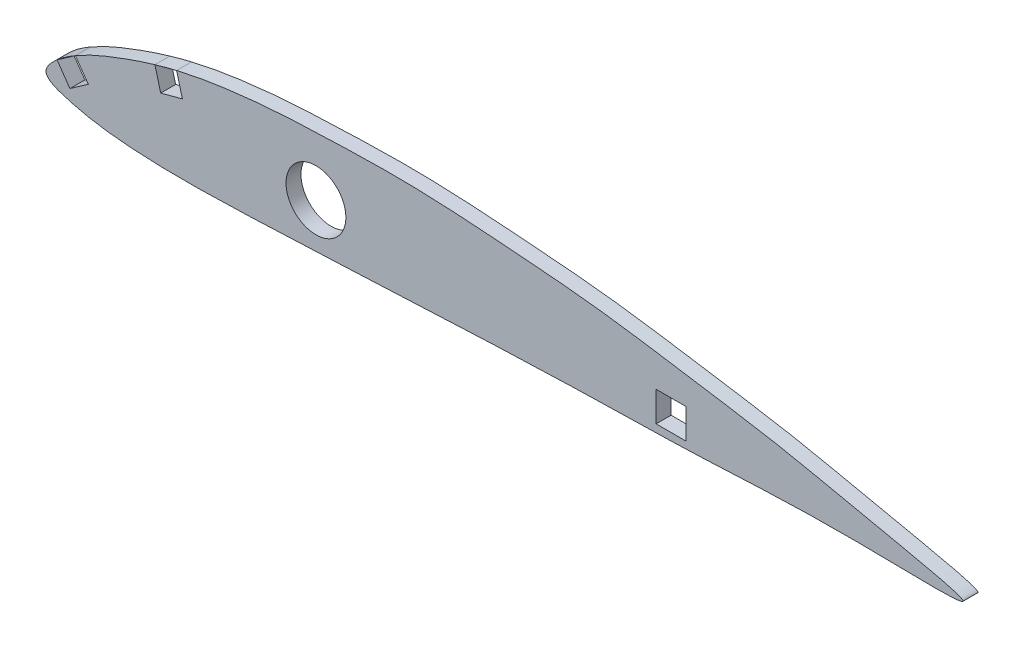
SolidWorks part; units mm, degrees
ref_plane "Front Plane" through (0, 0, 0) normal (0, 0, 1) x (1, 0, 0)
ref_plane "Top Plane" through (0, 0, 0) normal (0, 1, 0) x (1, 0, 0)
ref_plane "Right Plane" through (0, 0, 0) normal (1, 0, 0) x (0, 0, -1)
sketch3d "3DSketch1"
  spline S1 degree 3 poles (5.0393, -2.9926, 0) (-1.862, -0.8183, 0) (2.2189, 3.3769, 0) (5.4466, 5.6886, 0) (9.6299, 7.9412, 0) (17.641, 11.2, 0) (27.359, 14.3005, 0) (38.8624, 16.1401, 0) (48.6122, 17.1131, 0) (61.5901, 17.657, 0) (77.8288, 18.1176, 0) (97.2642, 16.7535, 0) (116.8399, 15.2282, 0) (135.9715, 12.1635, 0) (156.4945, 9.026, 0) (172.1569, 5.3413, 0) (205.497, -1.2627, 0) (162.3583, 0.2567, 0) (143.5982, -1.4601, 0) (103.1004, -2.0985, 0) (71.4433, -3.8235, 0) (38.8496, -5.2442, 0) (22.8315, -5.5069, 0) (11.0415, -4.365, 0) (5.0393, -2.9926, 0) (-1.862, -0.8183, 0) (2.2189, 3.3769, 0) knots -0.051806 -0.027094 -0.014492 0 0.01056 0.018211 0.03221 0.045525 0.084069 0.108974 0.133649 0.158233 0.207343 0.256523 0.305826 0.355445 0.405214 0.45539 0.506007 0.555122 0.65337 0.70249 0.849939 0.899083 0.948194 0.972906 0.985508 1 1.01056 1.018211 1.03221 only from (0, 0, 0) to (0, 0, 0)
  dimension "D1" = 194.52
extrude "Boss-Extrude1" add sketch "3DSketch1" along direction (0, 0, 1) on the side of the normal blind 3.175
sketch "Sketch1" plane through (0, 0, 3.175) normal (0, 0, 1) x (1, 0, 0)
  line L0 (0, 0) -> (194.52, 0) construction
  line L1 (97.26, 0) -> (97.26, 5) construction
  line L2 (97.26, 5) -> (57.26, 5) construction
  line L3 (2.3443, 3.3283) -> (6.2455, 6.06)
  line L4 (129.417, 6.35) -> (135.767, 6.35)
  line L5 (129.417, 6.35) -> (129.417, 0)
  line L6 (129.417, 0) -> (135.767, 0)
  line L7 (135.767, 6.35) -> (135.767, 0)
  line L8 (2.3443, 3.3283) -> (5.0759, -0.5729)
  line L9 (6.2455, 6.06) -> (8.9771, 2.1588)
  line L10 (5.0759, -0.5729) -> (8.9771, 2.1588)
  line L11 (23.1, 12.821) -> (27.7002, 14.0536)
  line L12 (23.1, 12.821) -> (24.3326, 8.2208)
  line L13 (27.7002, 14.0536) -> (28.9328, 9.4534)
  line L14 (24.3326, 8.2208) -> (28.9328, 9.4534)
  circle A0 centre (57.26, 5) radius 6.35
  spline S0 degree 3 poles (2.2189, 3.3769) (-1.862, -0.8183) (5.0393, -2.9926) (11.0415, -4.365) (22.8315, -5.5069) (38.8496, -5.2442) (71.4433, -3.8235) (103.1004, -2.0985) (143.5982, -1.4601) (162.3583, 0.2567) (205.497, -1.2627) (172.1569, 5.3413) (156.4945, 9.026) (135.9715, 12.1635) (116.8399, 15.2282) (97.2642, 16.7535) (77.8288, 18.1176) (61.5901, 17.657) (48.6122, 17.1131) (38.8624, 16.1401) (27.359, 14.3005) (17.641, 11.2) (9.6299, 7.9412) (5.4466, 5.6886) (2.2189, 3.3769) (-1.862, -0.8183) (5.0393, -2.9926) knots -0.03221 -0.018211 -0.01056 0 0.014492 0.027094 0.051806 0.100917 0.150061 0.29751 0.34663 0.444878 0.493993 0.54461 0.594786 0.644555 0.694174 0.743477 0.792657 0.841767 0.866351 0.891026 0.915931 0.954475 0.96779 0.981789 0.98944 1 1.014492 1.027094 1.051806 only from (0, 0) to (0, 0) construction
  dimension "D3" = 32.157
  dimension "D1" = 40
  dimension "D2" = 5
  dimension "D4" = 6.35
  dimension "D5" = 6.35
  dimension "D6" = 4.7625
  dimension "D7" = 4.7625
  dimension "D8" = 55
  dimension "D9" = 4.7625
  dimension "D10" = 4.7625
  dimension "D11" = 75
extrude "Cut-Extrude1" cut sketch "Sketch1" against normal blind 10
